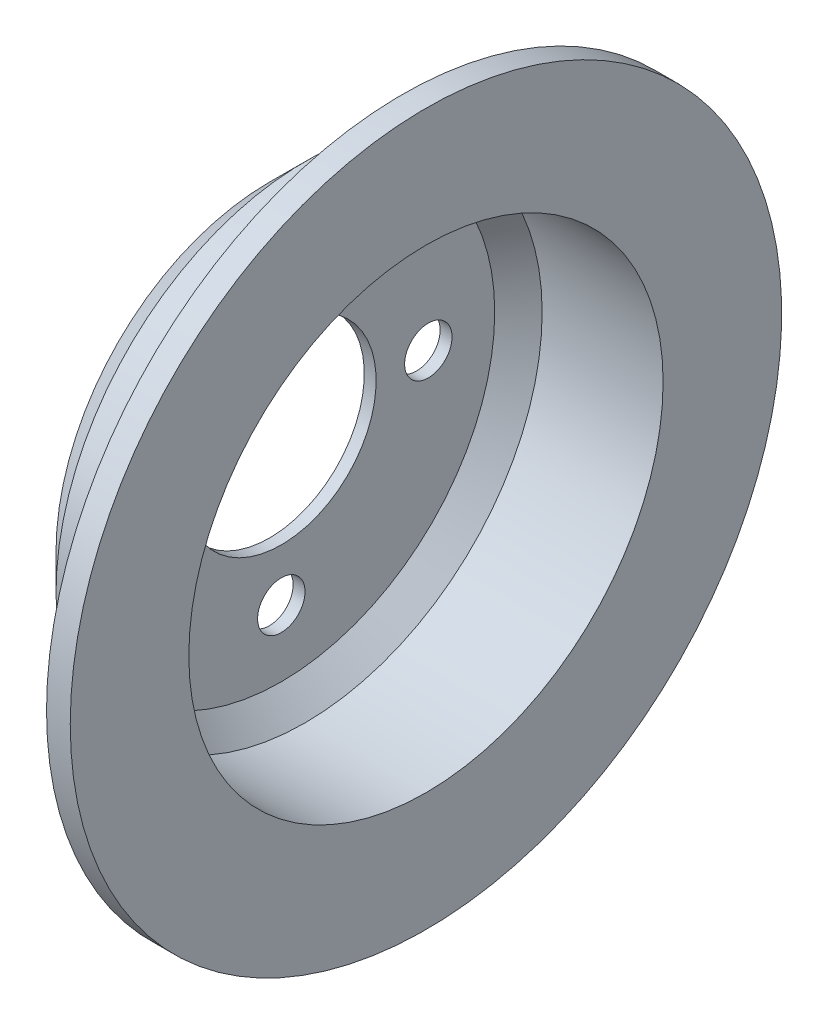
SolidWorks part; units mm, degrees
ref_plane "Front Plane" through (0, 0, 0) normal (0, 0, 1) x (1, 0, 0)
ref_plane "Top Plane" through (0, 0, 0) normal (0, 1, 0) x (1, 0, 0)
ref_plane "Right Plane" through (0, 0, 0) normal (1, 0, 0) x (0, 0, -1)
sketch "Sketch1" plane through (0, 0, 0) normal (0, 0, 1) x (1, 0, 0)
  line L0 (0, 0) -> (66, 0) construction
  line L1 (0, 40) -> (5, 40)
  line L2 (5, 40) -> (5, 90)
  line L3 (5, 90) -> (15, 100)
  line L4 (15, 100) -> (66, 100)
  line L5 (66, 100) -> (66, 150)
  line L6 (66, 150) -> (56, 150)
  line L7 (56, 150) -> (56, 110)
  line L8 (61, 110) -> (61, 105)
  line L9 (56, 110) -> (61, 110)
  line L10 (61, 105) -> (15, 105)
  line L11 (15, 105) -> (0, 90)
  line L12 (0, 90) -> (0, 40)
  dimension "D1" = 300
  dimension "D2" = 200
  dimension "D3" = 5
  dimension "D4" = 180
  dimension "D5" = 80
  dimension "D6" = 5
  dimension "D7" = 45
  dimension "D8" = 5
  dimension "D9" = 10
  dimension "D10" = 66
  dimension "D11" = 5
revolve "Revolve1" add sketch "Sketch1" angle 360 about L0
hole_wizard "Ø20.0 (20) Diameter Hole1" positions "Sketch3" profile "Sketch4" hole size "Ø20.0" standard "ANSI Metric"
sketch "Sketch3" plane through (5, 0, 0) normal (1, 0, 0) x (0, 0, -1)
  point P0 (0, 62)
  point P2 (62, 0)
  point P4 (-62, 0)
  point P6 (0, -62)
  dimension "D1" = 62
  dimension "D2" = 62
  dimension "D3" = 62
  dimension "D4" = 62
sketch "Sketch4" plane through (5, 62, 0) normal (0, 1, 0) x (0, 0, -1)
  line L0 (0, 0) -> (0, 5)
  line L1 (0, 5) -> (10, 5)
  line L2 (10, 5) -> (10, 0)
  line L5 (10, 0) -> (0, 0)
  line L11 (0, -6.35) -> (0, 107.95) construction
  dimension "Thru Hole Dia." = 20
  dimension "Thru Hole Depth" = 5
